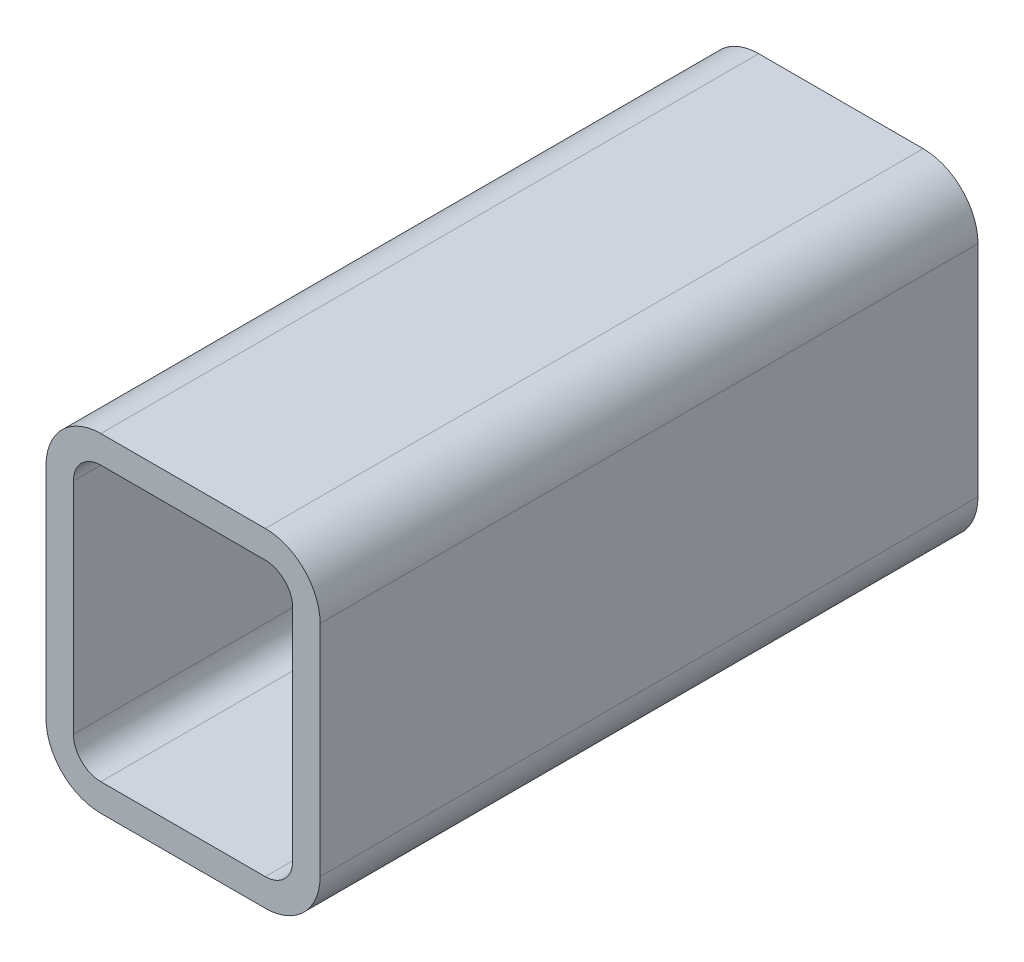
SolidWorks part; units mm, degrees
ref_plane "Front Plane" through (0, 0, 0) normal (0, 0, 1) x (1, 0, 0)
ref_plane "Top Plane" through (0, 0, 0) normal (0, 1, 0) x (1, 0, 0)
ref_plane "Right Plane" through (0, 0, 0) normal (1, 0, 0) x (0, 0, -1)
sketch "Sketch1" plane through (0, 0, 0) normal (0, 0, 1) x (1, 0, 0)
sketch_block_instance "HSS6x5x0.500-1"
sketch_block "HSS6x5x0.500"
extrude "Boss-Extrude1" add sketch "Sketch1" along normal blind 304.8
